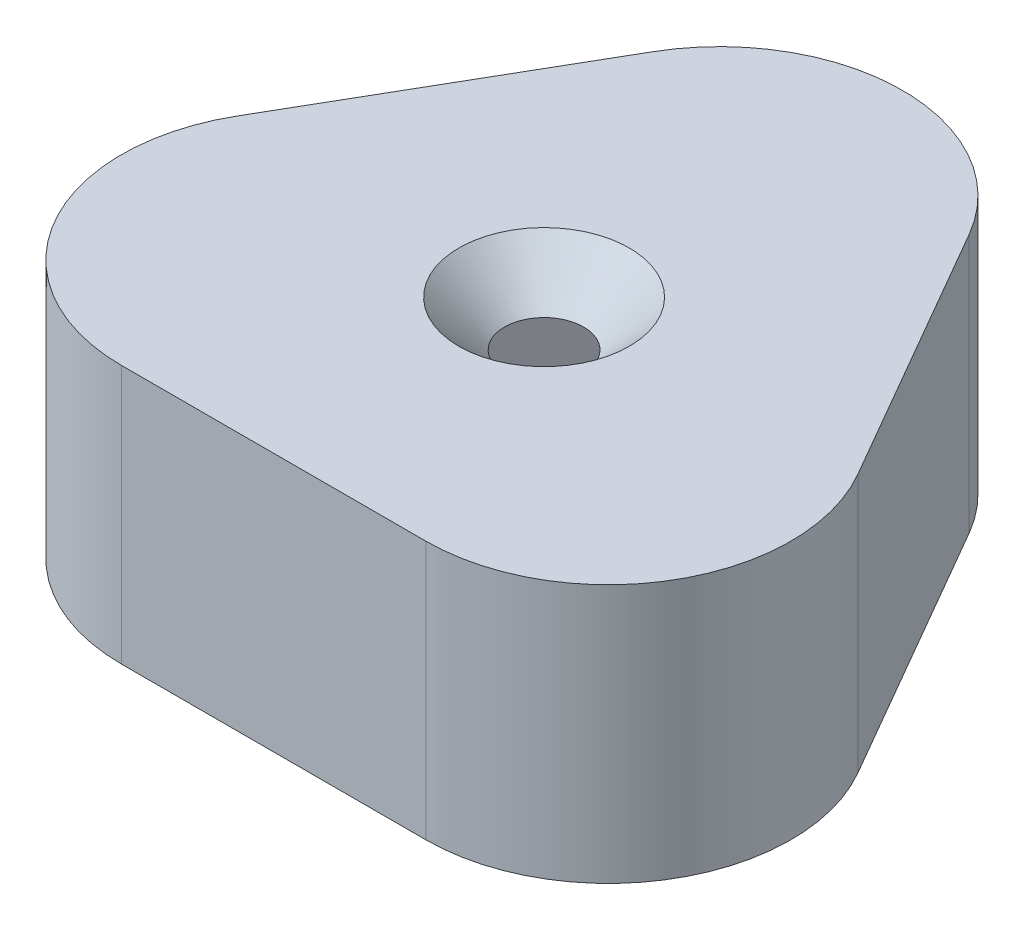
SolidWorks part; units mm, degrees
ref_plane "Спереди" through (0, 0, 0) normal (0, 0, 1) x (1, 0, 0)
ref_plane "Сверху" through (0, 0, 0) normal (0, 1, 0) x (1, 0, 0)
ref_plane "Справа" through (0, 0, 0) normal (1, 0, 0) x (0, 0, -1)
sketch "Эскиз1" plane through (0, 0, 0) normal (0, 1, 0) x (1, 0, 0)
  line L0 (0, 0) -> (0, 11.547) construction
  line L1 (0, 0) -> (10, -5.7735) construction
  line L2 (0, 0) -> (-10, -5.7735) construction
  line L3 (10.3923, 17.547) -> (20.3923, 0.2265)
  line L4 (10, -17.7735) -> (-10, -17.7735)
  line L5 (-10.3923, 17.547) -> (-20.3923, 0.2265)
  arc A0 (-10.3923, 17.547) -> (10.3923, 17.547) centre (0, 11.547) cw
  arc A1 (20.3923, 0.2265) -> (10, -17.7735) centre (10, -5.7735) cw
  arc A2 (-20.3923, 0.2265) -> (-10, -17.7735) centre (-10, -5.7735) ccw
  dimension "D1" = 12
  dimension "D5" = 41.3205
  dimension "D6" = 44
  dimension "D2" = 120
  dimension "D3" = 120
  dimension "D4" = 20
extrude "Бобышка-Вытянуть1" add sketch "Эскиз1" along normal blind 17
sketch "Эскиз2" plane through (0, 0, 0) normal (0, -1, 0) x (1, 0, 0)
  line L0 (-10, 15.2735) -> (10, 15.2735)
  line L1 (18.2272, 1.0235) -> (8.2272, -16.297)
  line L2 (-18.2272, 1.0235) -> (-8.2272, -16.297)
  arc A0 (18.2272, 1.0235) -> (10, 15.2735) centre (10, 5.7735) ccw
  arc A1 (-10, 15.2735) -> (-18.2272, 1.0235) centre (-10, 5.7735) ccw
  arc A2 (-8.2272, -16.297) -> (8.2272, -16.297) centre (0, -11.547) ccw
  arc A3 (20.3923, -0.2265) -> (10, 17.7735) centre (10, 5.7735) ccw construction
  arc A4 (-10, 17.7735) -> (-20.3923, -0.2265) centre (-10, 5.7735) ccw construction
  arc A5 (-10.3923, -17.547) -> (10.3923, -17.547) centre (0, -11.547) ccw construction
  dimension "D1" = 19
extrude "Вырез-Вытянуть1" cut sketch "Эскиз2" against normal offset from surface (14 mm away) 3
sketch "Эскиз3" plane through (0, 0, 0) normal (0, -1, 0) x (1, 0, 0)
  line L6 (9.3098, -16.922) -> (19.3098, 0.3985)
  line L7 (-19.3098, 0.3985) -> (-9.3098, -16.922)
  line L8 (10, 16.5235) -> (-10, 16.5235)
  line L9 (9.3098, -16.922) -> (19.3098, 0.3985)
  line L10 (-19.3098, 0.3985) -> (-9.3098, -16.922)
  line L11 (10, 16.5235) -> (-10, 16.5235)
  arc A6 (-9.3098, -16.922) -> (9.3098, -16.922) centre (0, -11.547) ccw
  arc A7 (-10, 16.5235) -> (-19.3098, 0.3985) centre (-10, 5.7735) ccw
  arc A8 (19.3098, 0.3985) -> (10, 16.5235) centre (10, 5.7735) ccw
  arc A9 (-9.3098, -16.922) -> (9.3098, -16.922) centre (0, -11.547) ccw
  arc A10 (-10, 16.5235) -> (-19.3098, 0.3985) centre (-10, 5.7735) ccw
  arc A11 (19.3098, 0.3985) -> (10, 16.5235) centre (10, 5.7735) ccw
  dimension "D1" = 1.25
extrude "Вырез-Вытянуть2" cut sketch "Эскиз3" against normal blind 1.25
sketch "Эскиз4" plane through (0, 14, 0) normal (0, -1, 0) x (1, 0, 0)
  circle A0 centre (0, 0) radius 2.1
  dimension "D1" = 4.2
extrude "Вырез-Вытянуть3" cut sketch "Эскиз4" against normal through all
chamfer "Фаска1" distance 3.5 angle 45 1 edges at (0, 17, -2.1)
